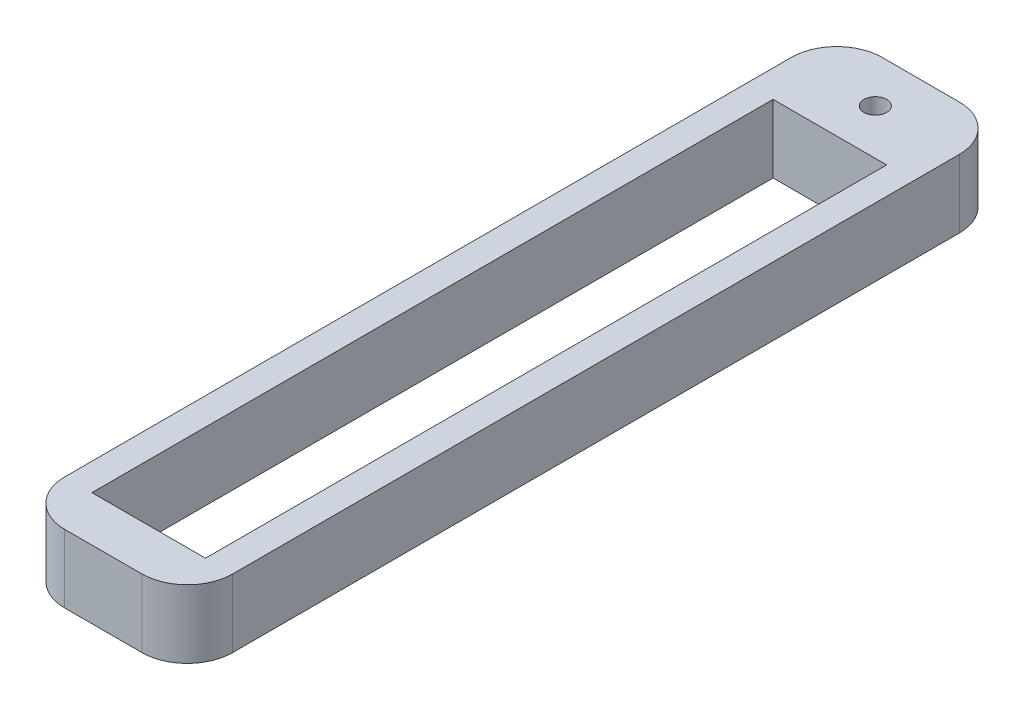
SolidWorks part; units mm, degrees
ref_plane "Alzado" through (0, 0, 0) normal (0, 0, 1) x (1, 0, 0)
ref_plane "Planta" through (0, 0, 0) normal (0, 1, 0) x (1, 0, 0)
ref_plane "Vista lateral" through (0, 0, 0) normal (1, 0, 0) x (0, 0, -1)
sketch "Croquis1" plane through (0, 0, 0) normal (0, 1, 0) x (1, 0, 0)
  line L0 (0, 0) -> (-1.2, 0) construction
  line L1 (0, 0) -> (5, 0)
  line L2 (0, 0) -> (0, 30)
  line L3 (0, 30) -> (5, 30)
  line L4 (5, 0) -> (5, 30)
  line L5 (-1.2, 0) -> (-1.2, -2) construction
  line L6 (-1.2, 30) -> (-1.2, 34) construction
  line L7 (2.5, 30) -> (2.5, 0) construction
  line L8 (6.2, 30) -> (6.2, 34) construction
  line L10 (0.8, -2) -> (4.2, -2)
  line L11 (-1.2, 0) -> (-1.2, 32)
  line L12 (0.8, 34) -> (4.2, 34)
  line L13 (6.2, 0) -> (6.2, 32)
  arc A0 (0.8, 34) -> (-1.2, 32) centre (0.8, 32) ccw
  arc A1 (6.2, 32) -> (4.2, 34) centre (4.2, 32) ccw
  arc A2 (4.2, -2) -> (6.2, 0) centre (4.2, 0) ccw
  arc A3 (0.8, -2) -> (-1.2, 0) centre (0.8, 0) cw
  circle A4 centre (2.5, 32) radius 0.5
  dimension "D7" = 2
  dimension "D8" = 2
  dimension "D9" = 2
  dimension "D10" = 1
  dimension "D11" = 2
  dimension "D12" = 3.7
  dimension "D1" = 30
  dimension "D2" = 5
  dimension "D3" = 1.2
  dimension "D4" = 2
  dimension "D5" = 4
  dimension "D6" = 1.2
extrude "Saliente-Extruir1" add sketch "Croquis1" along normal blind 3
